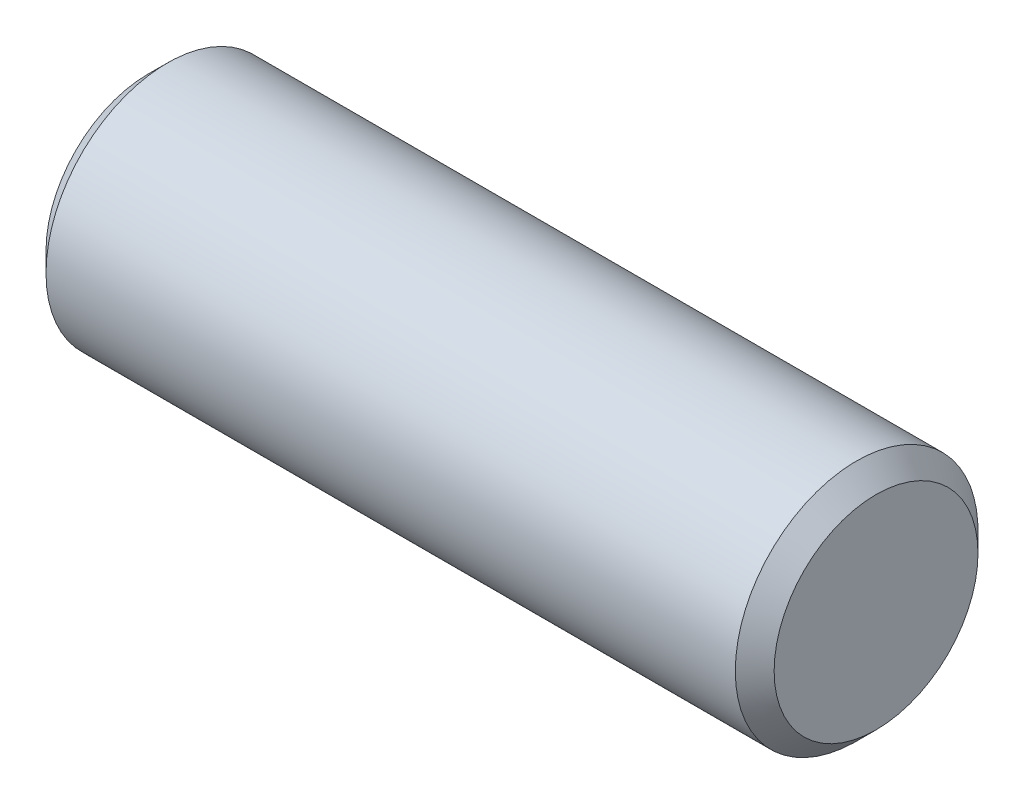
SolidWorks part; units mm, degrees
ref_plane "Front" through (0, 0, 0) normal (0, 0, 1) x (1, 0, 0)
ref_plane "Top" through (0, 0, 0) normal (0, 1, 0) x (1, 0, 0)
ref_plane "Right" through (0, 0, 0) normal (1, 0, 0) x (0, 0, -1)
sketch "Sketch1" plane through (0, 0, 0) normal (1, 0, 0) x (0, 0, -1)
  circle A0 centre (0, 0) radius 3.175
  circle A1 centre (0, 0) radius 3.175 construction
extrude "Base-Extrude" add sketch "Sketch1" along normal mid plane 19.05
chamfer "Chamfer1" distance 0.508 angle 45 2 edges at (-9.525, 0, -3.175) (9.525, 0, -3.175)
